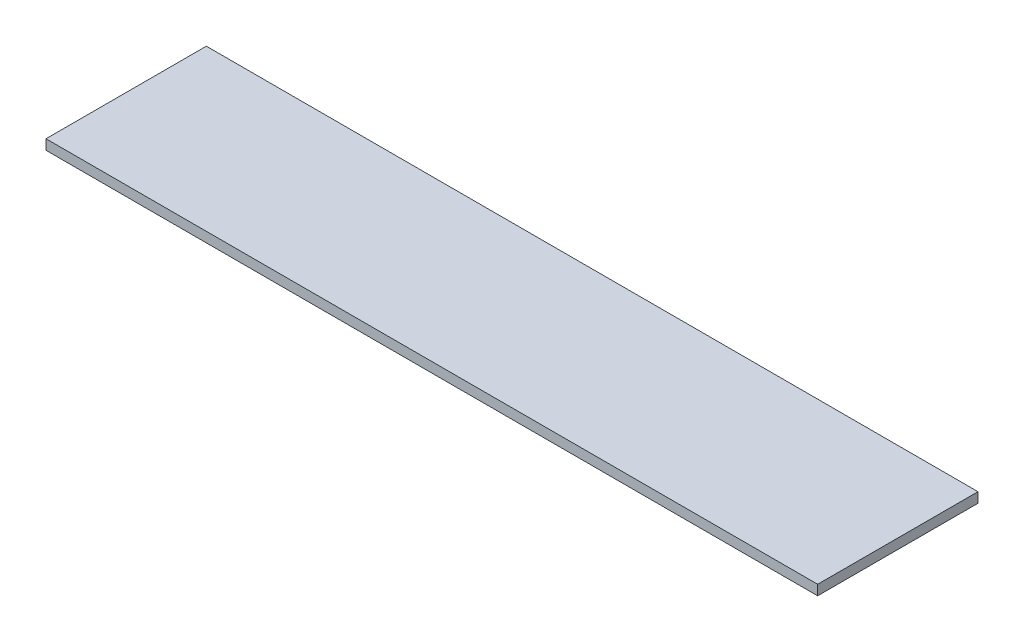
SolidWorks part; units mm, degrees
ref_plane "Plan de face" through (0, 0, 0) normal (0, 0, 1) x (1, 0, 0)
ref_plane "Plan de dessus" through (0, 0, 0) normal (0, 1, 0) x (1, 0, 0)
ref_plane "Plan de droite" through (0, 0, 0) normal (1, 0, 0) x (0, 0, -1)
sketch "Esquisse1" plane through (0, 0, 0) normal (0, 1, 0) x (1, 0, 0)
  line L1 (-770, -160) -> (770, -160)
  line L2 (-770, -160) -> (-770, 160)
  line L3 (-770, 160) -> (770, 160)
  line L4 (770, -160) -> (770, 160)
  line L5 (-770, -160) -> (770, 160) construction
  line L6 (-770, 160) -> (770, -160) construction
  point P0 (0, 0)
  dimension "D1" = 1540
  dimension "D2" = 320
extrude "Boss.-Extru.1" add sketch "Esquisse1" along normal mid plane 20
